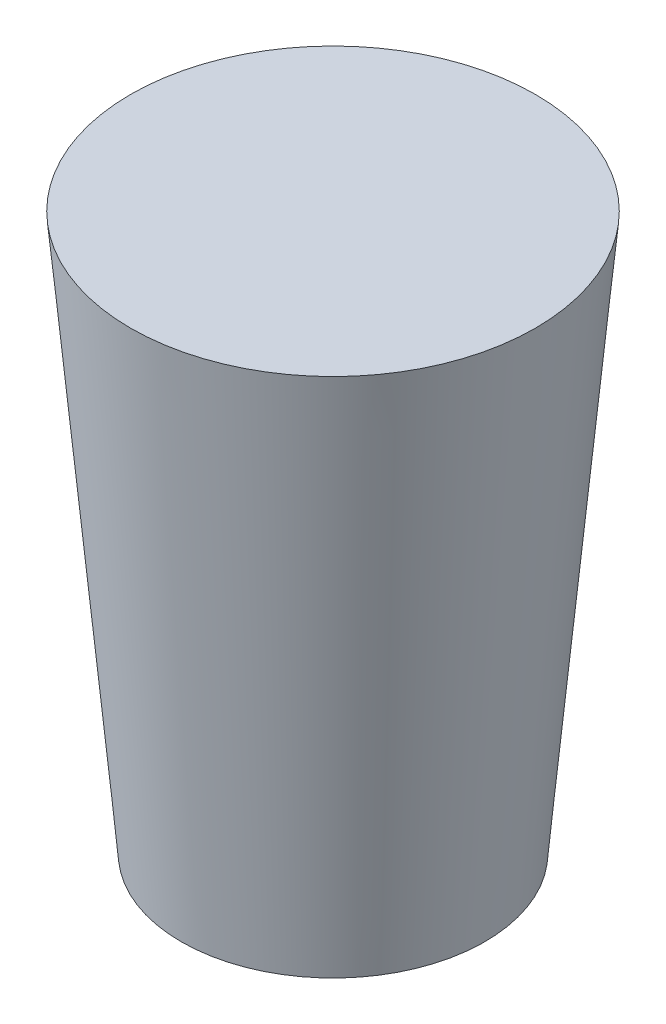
SolidWorks part; units mm, degrees
ref_plane "Plan de face" through (0, 0, 0) normal (0, 0, 1) x (1, 0, 0)
ref_plane "Plan de dessus" through (0, 0, 0) normal (0, 1, 0) x (1, 0, 0)
ref_plane "Plan de droite" through (0, 0, 0) normal (1, 0, 0) x (0, 0, -1)
sketch "Esquisse1" plane through (0, 0, 0) normal (0, 0, 1) x (1, 0, 0)
  line L0 (-15.0396, -25.3849) -> (-24.0396, -25.3849)
  line L1 (-24.0396, -25.3849) -> (-27.0396, 7.6151)
  line L2 (-27.0396, 7.6151) -> (-15.0396, 7.6151)
  line L3 (-15.0396, 7.6151) -> (-15.0396, -25.3849)
  dimension "D1" = 12
  dimension "D2" = 9
  dimension "D3" = 33
revolve "Révolution1" add sketch "Esquisse1" angle 360 about L3
